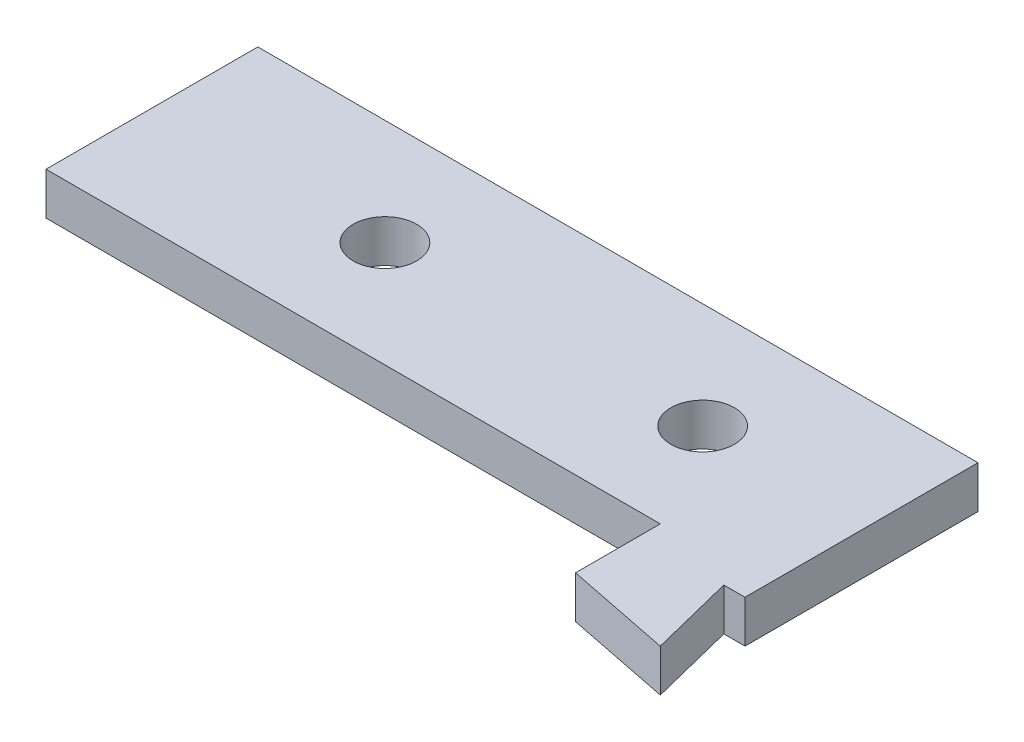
SolidWorks part; units mm, degrees
ref_plane "Front Plane" through (0, 0, 0) normal (0, 0, 1) x (1, 0, 0)
ref_plane "Top Plane" through (0, 0, 0) normal (0, 1, 0) x (1, 0, 0)
ref_plane "Right Plane" through (0, 0, 0) normal (1, 0, 0) x (0, 0, -1)
sketch "Sketch1" plane through (0, 0, 0) normal (0, 1, 0) x (1, 0, 0)
  line L1 (0, 0) -> (68, 0)
  line L2 (0, 0) -> (0, 30)
  line L3 (0, 30) -> (68, 30)
  line L4 (68, 0) -> (68, 30)
  dimension "D1" = 68
  dimension "D2" = 30
extrude "Extrude1" add sketch "Sketch1" along normal blind 4
sketch "Sketch2" plane through (0, 4, 0) normal (0, 1, 0) x (1, 0, 0)
  line L0 (0, 30) -> (0, 0) construction
  line L1 (68, 30) -> (0, 30) construction
  circle A0 centre (22, 20) radius 3
  circle A1 centre (52, 20) radius 3
  dimension "D1" = 22
  dimension "D2" = 10
  dimension "D3" = 10
  dimension "D4" = 30
  dimension "D5" = 6
extrude "Cut-Extrude1" cut sketch "Sketch2" against normal through all
sketch "Sketch3" plane through (0, 4, 0) normal (0, 1, 0) x (1, 0, 0)
  line L0 (68, 0) -> (66, 8)
  line L1 (66, 8) -> (68, 8)
  line L2 (68, 0) -> (68, 30) construction
  line L3 (68, 8) -> (68, 0)
  dimension "D1" = 2
  dimension "D2" = 8
extrude "Cut-Extrude2" cut sketch "Sketch3" against normal through all
sketch "Sketch4" plane through (0, 4, 0) normal (0, 1, 0) x (1, 0, 0)
  line L0 (68, 0) -> (58, 2)
  line L1 (58, 2) -> (58, 10)
  line L2 (58, 10) -> (0, 10)
  line L3 (0, 30) -> (0, 0) construction
  line L4 (0, 10) -> (0, 0)
  line L5 (0, 0) -> (68, 0)
  line L6 (68, 30) -> (0, 30) construction
  dimension "D1" = 20
  dimension "D2" = 10
  dimension "D3" = 8
extrude "Cut-Extrude3" cut sketch "Sketch4" against normal through all
